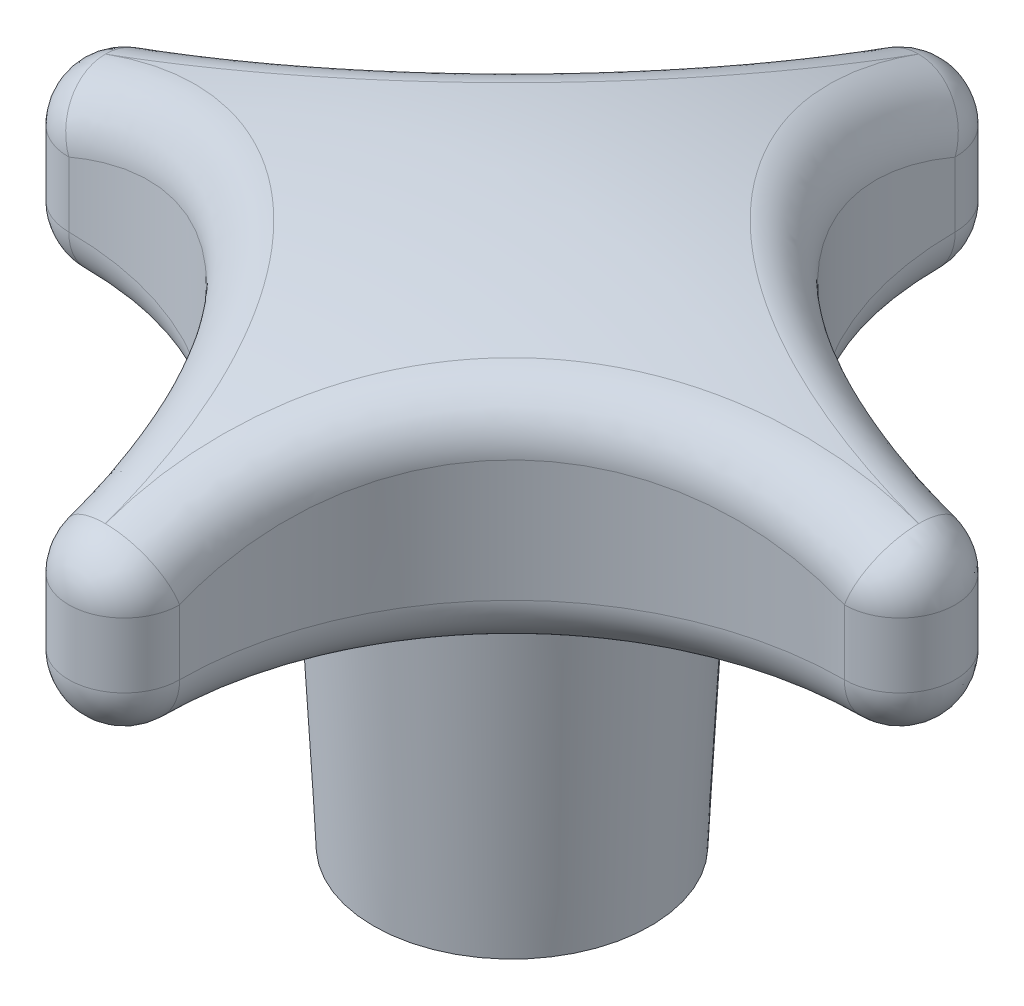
SolidWorks part; units mm, degrees
ref_plane "Front Plane" through (0, 0, 0) normal (0, 0, 1) x (1, 0, 0)
ref_plane "Top Plane" through (0, 0, 0) normal (0, 1, 0) x (1, 0, 0)
ref_plane "Right Plane" through (0, 0, 0) normal (1, 0, 0) x (0, 0, -1)
sketch "Sketch1" plane through (0, 0, 0) normal (0, 1, 0) x (1, 0, 0)
  circle A0 centre (0, 0) radius 12.5
  dimension "D1" = 25
extrude "Extrude1" add sketch "Sketch1" against normal blind 28
draft "Draft1" type of draft neutral plane draft angle 3 faces to draft 1 parameters "D1"=3
sketch "Sketch2" plane through (0, 0, 0) normal (0, 0, 1) x (1, 0, 0)
  line L0 (0, 0) -> (-40, 0)
  line L1 (-40, 0) -> (-40, 14.3)
  line L2 (0, 0) -> (0, 50000) construction
  line L3 (0, 22) -> (20.2547, 22) construction
  line L4 (0, 0) -> (0, 22)
  arc A0 (0, 22) -> (-40, 14.3) centre (0, -85.7461) ccw
revolve "Revolve1" add sketch "Sketch2" angle 360 about L2
sketch "Sketch4" plane through (0, 0, 0) normal (0, 1, 0) x (1, 0, 0)
  line L0 (0, 0) -> (-50000, 0) construction
  line L1 (0, 0) -> (0, 50000) construction
  line L2 (-35, 5) -> (-45.9117, 5) construction
  line L3 (-5, 35) -> (-5, 40.3224) construction
  arc A0 (0, 40) -> (-5, 35) centre (0, 35) ccw
  arc A1 (-35, 5) -> (-40, 0) centre (-35, 0) ccw
  circle A2 centre (0, 0) radius 40 construction
  arc A3 (-35, 5) -> (-5, 35) centre (-35, 35) ccw
  arc A4 (0, 40) -> (-40, 0) centre (-40, 40) ccw
  point P9 (0, 40)
  point P10 (-40, 0)
  point P13 (-5, 35)
  point P14 (-35, 5)
extrude "Extrude3" cut sketch "Sketch4" along normal through all
pattern_circular "CirPattern1" count 4 over 360 about axis through (0, 0, 0) along (0, 1, 0) of "Extrude3"
fillet "Fillet2" radius 5 16 edges at (0, 0, 40) (13.7868, 0, 13.7868) (40, 0, 0) (13.7868, 0, -13.7868) (0, 0, -40) (-13.7868, 0, -13.7868) (-40, 0, 0) (-0.0002, 14.3, 40) (16.9199, 20.0868, 11.0603) (40, 14.3, 0.0002) (11.0603, 20.0868, -16.9199) (0.0002, 14.3, -40) (-16.9199, 20.0868, -11.0603) (-40, 14.3, 0.0002) (-13.7868, 0, 13.7868) (-11.0603, 20.0868, 16.9199)
sketch "Sketch6" plane through (0, -28, 0) normal (0, -1, 0) x (1, 0, 0)
  circle A0 centre (0, 0) radius 8
  dimension "D1" = 16
extrude "Extrude5" [suppressed] cut sketch "Sketch6" against normal blind 32
sketch "Sketch7" [suppressed] plane through (0, 0, 0) normal (0, 0, 1) x (1, 0, 0)
  line L0 (-0.125, 1) -> (5, 1)
  line L1 (5, -20) -> (5, 1) construction
  line L2 (5, 1) -> (-0.125, 3.9589)
  line L3 (-0.125, 3.9589) -> (-0.125, 1)
  line L4 (-5, -20) -> (5, -20) construction
revolve "Cut-Revolve1" [suppressed] cut sketch "Sketch7" angle 360 about L3
sketch "Sketch10" plane through (0, -28, 0) normal (0, -1, 0) x (1, 0, 0)
  circle A0 centre (0, 0) radius 7
  dimension "D1" = 14
extrude "Extrude8" cut sketch "Sketch10" against normal blind 32
sketch "Sketch11" plane through (0, 0, 0) normal (0, 0, 1) x (1, 0, 0)
  line L0 (0, 4) -> (7, 4)
  line L1 (-7, 4) -> (7, 4) construction
  line L2 (7, 4) -> (0, 8.0415)
  line L3 (0, 8.0415) -> (0, 4)
  dimension "D1" = 30
revolve "Cut-Revolve2" cut sketch "Sketch11" angle 360 about L3
equation "\"D2@Sketch2\" = \"D1@Sketch2\"*.65"
equation "\"D1@Sketch4\" = (\"D3@Sketch2\"*2)/8"
equation "\"D2@Sketch4\" =( \"D3@Sketch2\"*2)/8"
equation "\"D1@Sketch7\" = \"D1@Extrude5\""
